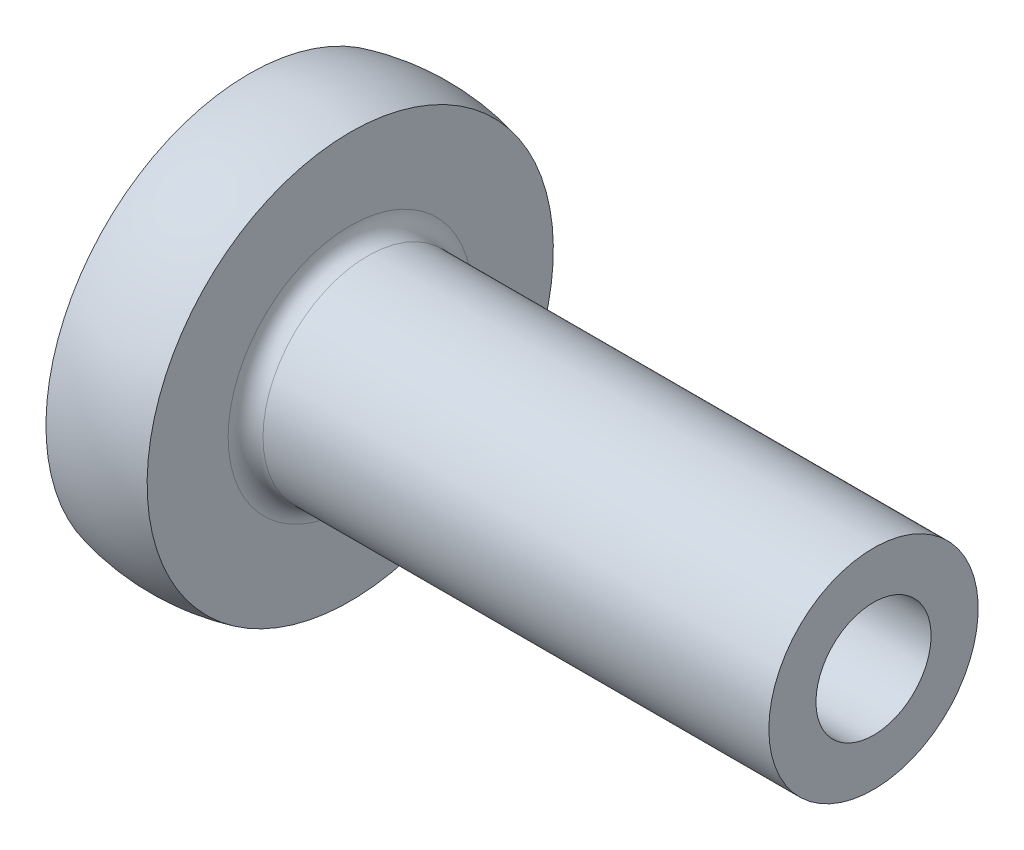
SolidWorks part; units mm, degrees
ref_plane "Front" through (0, 0, 0) normal (0, 0, 1) x (1, 0, 0)
ref_plane "Top" through (0, 0, 0) normal (0, 1, 0) x (1, 0, 0)
ref_plane "Right" through (0, 0, 0) normal (1, 0, 0) x (0, 0, -1)
sketch "Sketch1" plane through (0, 0, 0) normal (0, 0, 1) x (1, 0, 0)
  line L0 (0, 1.1644) -> (0, 0)
  line L1 (0.58, 1.1644) -> (0.58, 0.6)
  line L2 (0, 0) -> (1.9495, 0)
  line L3 (3.58, 0.33) -> (3.58, 0.6)
  line L4 (3.58, 0.6) -> (0.58, 0.6)
  line L5 (-2.3183, 0) -> (6.9456, 0) construction
  line L6 (3.58, 0.33) -> (2.14, 0.33)
  line L7 (2.14, 0.33) -> (1.9495, 0)
  arc A0 (0.58, 1.1644) -> (0, 1.1644) centre (0.29, 0) ccw
  dimension "dk" = 2.4
  dimension "D2" = 60
  dimension "K" = 0.58
  dimension "D3" = 0.29
  dimension "l" = 3
  dimension "d" = 1.2
  dimension "dt" = 0.66
  dimension "t" = 1.44
revolve "Base-Revolve" add sketch "Sketch1" angle 360 about L5
fillet "Fillet1" radius 0.1 1 edges at (0.58, 0, 0.6)
equation "\"D3@Sketch1\" = \"K@Sketch1\" / 2"
